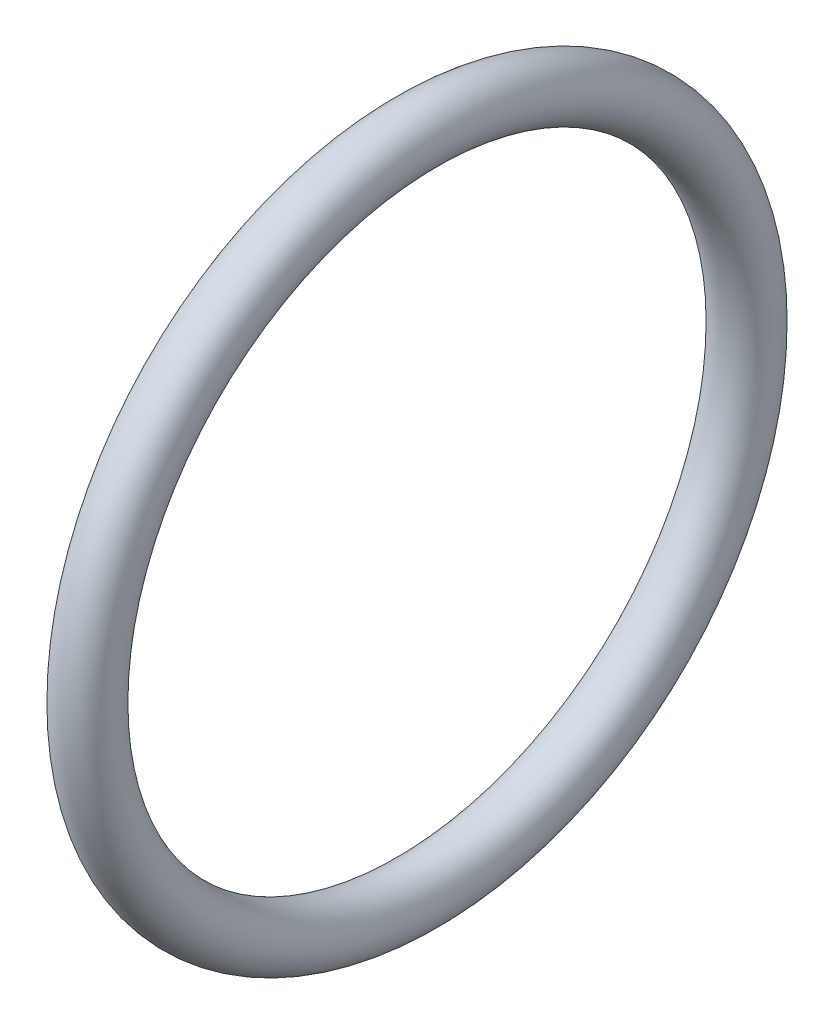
SolidWorks part; units mm, degrees
ref_plane "Front" through (0, 0, 0) normal (0, 0, 1) x (1, 0, 0)
ref_plane "Top" through (0, 0, 0) normal (0, 1, 0) x (1, 0, 0)
ref_plane "Right" through (0, 0, 0) normal (1, 0, 0) x (0, 0, -1)
sketch "Sketch1" plane through (0, 0, 0) normal (0, 0, 1) x (1, 0, 0)
  line L0 (0, 0) -> (12.8948, 0) construction
  line L1 (0, 0) -> (0, 13.1445) construction
  circle A0 centre (1.143, 13.1445) radius 1.143
  dimension "D1" = 2.286
  dimension "D2" = 28.575
revolve "Base-Revolve" add sketch "Sketch1" angle 360 about L0
